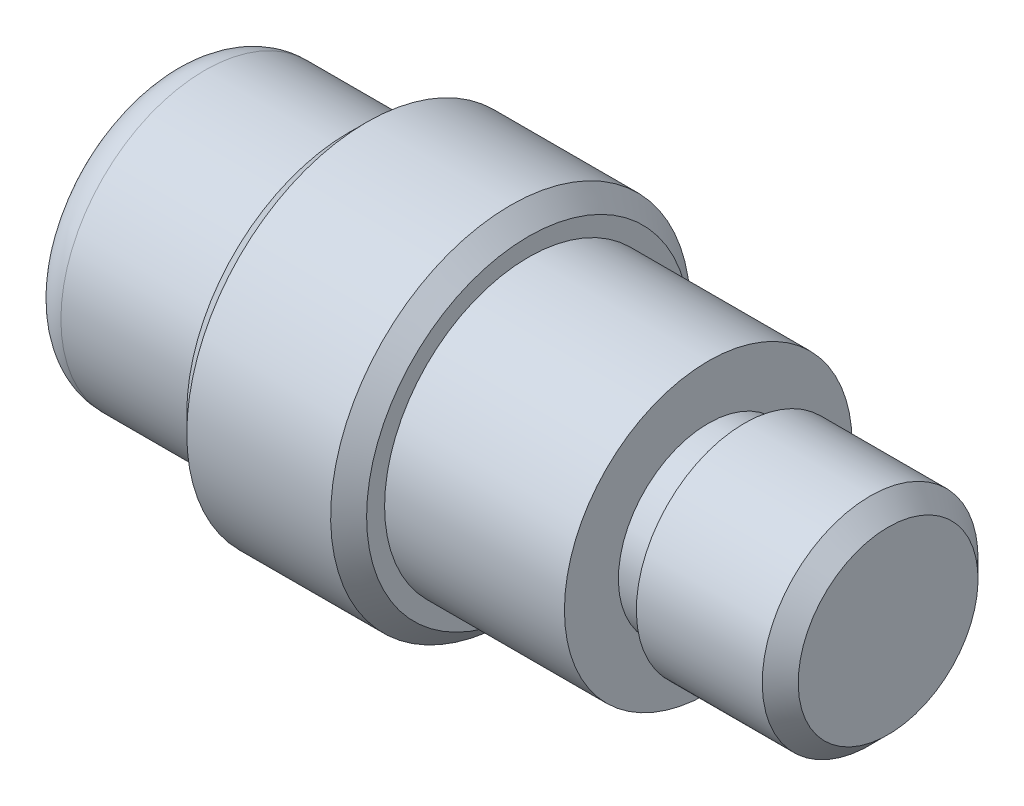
SolidWorks part; units mm, degrees
ref_plane "前视基准面" through (0, 0, 0) normal (0, 0, 1) x (1, 0, 0)
ref_plane "上视基准面" through (0, 0, 0) normal (0, 1, 0) x (1, 0, 0)
ref_plane "右视基准面" through (0, 0, 0) normal (1, 0, 0) x (0, 0, -1)
sketch "草图1" plane through (0, 0, 0) normal (0, 0, 1) x (1, 0, 0)
  line L0 (-30, 0) -> (-30, 8)
  line L1 (-30, 8) -> (-20, 8)
  line L2 (-20, 8) -> (-20, 10)
  line L3 (-20, 10) -> (-10, 10)
  line L4 (-10, 10) -> (-10, 8)
  line L5 (-10, 8) -> (0, 8)
  line L6 (0, 8) -> (0, 5)
  line L7 (0, 5) -> (2, 5)
  line L8 (2, 6) -> (10, 6)
  line L9 (10, 6) -> (10, 0)
  line L10 (2, 6) -> (2, 5)
  line L11 (38.7898, 0) -> (-60.5732, 0) construction
  line L12 (-30, 0) -> (10, 0)
  dimension "D1" = 40
  dimension "D2" = 10
  dimension "D3" = 10
  dimension "D4" = 2
  dimension "D5" = 10
  dimension "D6" = 8
  dimension "D7" = 5
  dimension "D8" = 6
  dimension "D9" = 10
  dimension "D10" = 8
revolve "旋转2" add sketch "草图1" angle 360 about L11
chamfer "倒角3" distance 1 angle 45 3 edges at (10, 6, 0) (-10, 10, 0) (-20, 10, 0)
fillet "圆角2" radius 2 1 edges at (-30, 8, 0)
